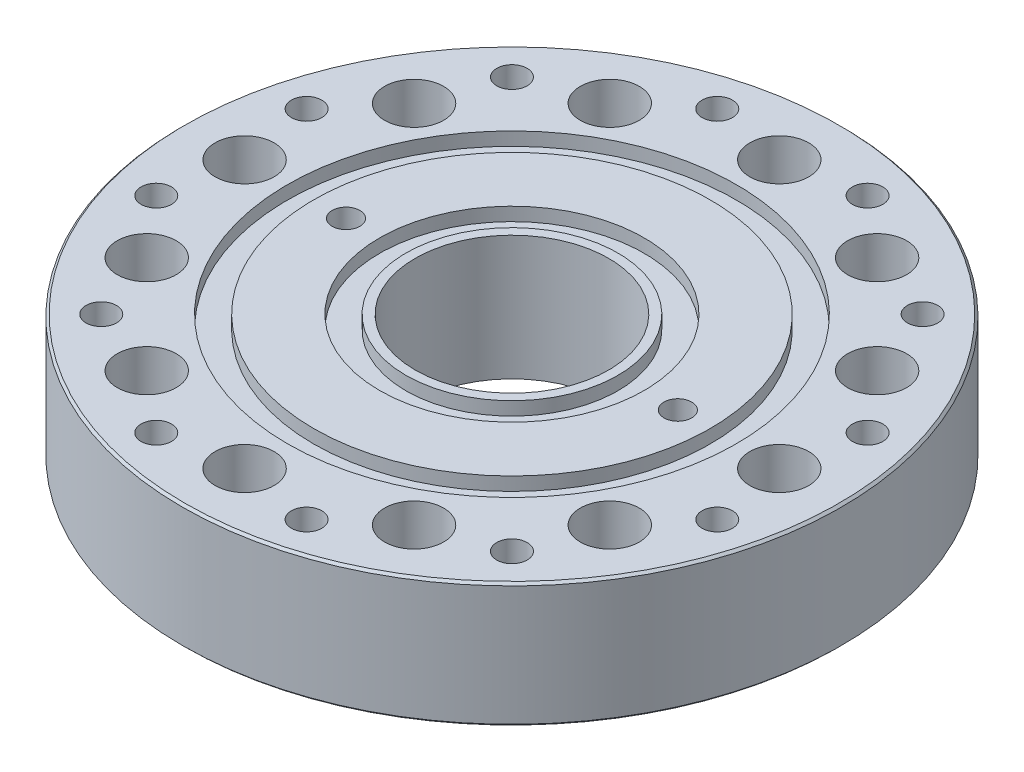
SolidWorks part; units mm, degrees
ref_plane "Front Plane" through (0, 0, 0) normal (0, 0, 1) x (1, 0, 0)
ref_plane "Top Plane" through (0, 0, 0) normal (0, 1, 0) x (1, 0, 0)
ref_plane "Right Plane" through (0, 0, 0) normal (1, 0, 0) x (0, 0, -1)
imported_body "Backplate port blank.step<1>"
sketch "Sketch1" plane through (0, -22.5, 0) normal (0, -1, 0) x (1, 0, 0)
  circle A0 centre (-18, 0) radius 1.5
  circle A1 centre (18, 0) radius 1.5
extrude "R06 two D3 coolant passages THROUGH" cut sketch "Sketch1" against normal blind 13.5
sketch "Sketch2" plane through (0, -22.5, 0) normal (0, -1, 0) x (1, 0, 0)
  circle A0 centre (-18, 0) radius 2.1
  circle A1 centre (18, 0) radius 2.1
extrude "R06 two D4.2 tap drills DEPTH5 - M5x0.8 THREAD4" cut sketch "Sketch2" against normal blind 5
